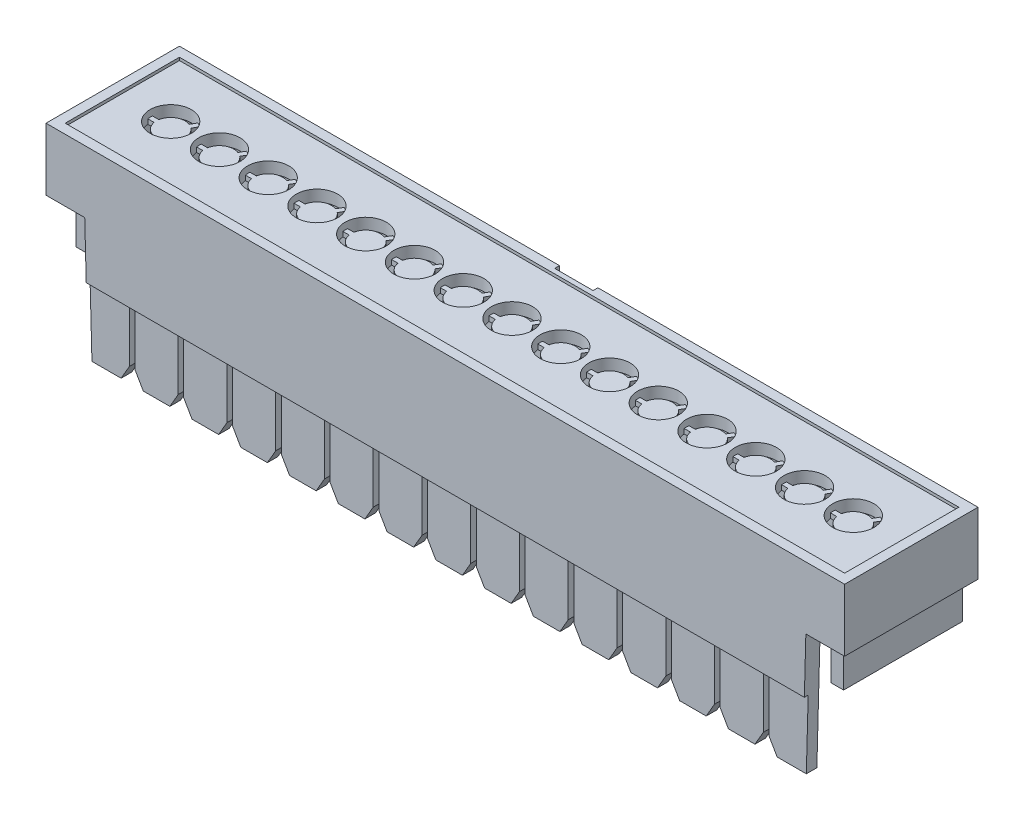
SolidWorks part; units mm, degrees
ref_plane "Спереди" through (0, 0, 0) normal (0, 0, 1) x (1, 0, 0)
ref_plane "Сверху" through (0, 0, 0) normal (0, 1, 0) x (1, 0, 0)
ref_plane "Справа" through (0, 0, 0) normal (1, 0, 0) x (0, 0, -1)
sketch "Эскиз1" plane through (0, 0, 0) normal (0, 1, 0) x (1, 0, 0)
  line L1 (41.6, -6.95) -> (-41.6, -6.95)
  line L2 (41.6, -6.95) -> (41.6, 6.95)
  line L3 (41.6, 6.95) -> (-41.6, 6.95)
  line L4 (-41.6, -6.95) -> (-41.6, 6.95)
  line L5 (41.6, -6.95) -> (-41.6, 6.95) construction
  line L6 (41.6, 6.95) -> (-41.6, -6.95) construction
  point P0 (0, 0)
  dimension "D1" = 13.9
  dimension "D2" = 83.2
extrude "Бобышка-Вытянуть1" add sketch "Эскиз1" against normal blind 6.5
sketch "Эскиз2" plane through (0, -6.5, 0) normal (0, -1, 0) x (1, 0, 0)
  line L0 (-41.6, 6.95) -> (41.6, 6.95) construction
  line L1 (38.7, -5.45) -> (-38.7, -5.45)
  line L2 (38.7, -5.45) -> (38.7, 5.45)
  line L3 (38.7, 5.45) -> (-38.7, 5.45)
  line L4 (-38.7, -5.45) -> (-38.7, 5.45)
  line L5 (38.7, -5.45) -> (-38.7, 5.45) construction
  line L6 (38.7, 5.45) -> (-38.7, -5.45) construction
  line L7 (-41.6, -6.95) -> (-41.6, 6.95) construction
  point P0 (0, 0)
  dimension "D1" = 1.5
  dimension "D2" = 2.9
extrude "Вырез-Вытянуть1" cut sketch "Эскиз2" against normal blind 5
sketch "Эскиз3" plane through (0, -6.5, 0) normal (0, -1, 0) x (1, 0, 0)
  line L0 (-38.7, 5.45) -> (-40, 5.45)
  line L1 (-40, 5.45) -> (-40, -6.95)
  line L2 (41.6, -6.95) -> (-41.6, -6.95) construction
  line L3 (-40, -6.95) -> (40, -6.95)
  line L4 (40, -6.95) -> (40, 5.45)
  line L5 (40, 5.45) -> (38.7, 5.45)
  line L6 (38.7, 5.45) -> (38.7, -5.45)
  line L7 (38.7, -5.45) -> (-38.7, -5.45)
  line L8 (-38.7, -5.45) -> (-38.7, 5.45)
  line L9 (0, 6.95) -> (0, -6.95) construction
  line L10 (-41.6, 6.95) -> (41.6, 6.95) construction
  dimension "D1" = 1.3
extrude "Бобышка-Вытянуть2" add sketch "Эскиз3" along normal blind 4.6
sketch "Эскиз4" plane through (0, 0, -6.95) normal (0, 0, -1) x (-1, 0, 0)
  line L0 (0, 0) -> (0, -11.1) construction
  line L1 (40, -11.1) -> (-40, -11.1) construction
  line L2 (-38.7, -11.1) -> (-38.7, -1.5)
  line L3 (-38.7, -1.5) -> (-37.7, -1.5)
  line L4 (-37.7, -1.5) -> (-37.4673, -10.1)
  line L5 (-37.4673, -10.1) -> (37.4673, -10.1)
  line L6 (37.4673, -10.1) -> (37.7, -1.5)
  line L7 (37.7, -1.5) -> (38.7, -1.5)
  line L8 (38.7, -1.5) -> (38.7, -11.1)
  line L9 (38.7, -11.1) -> (-38.7, -11.1)
  line L10 (-38.7, -11.1) -> (-38.7, -6.5) construction
  line L11 (-41.6, 0) -> (41.6, 0) construction
  dimension "D1" = 1
  dimension "D2" = 1
  dimension "D3" = 91.55
  dimension "D4" = 1.5
extrude "Вырез-Вытянуть2" cut sketch "Эскиз4" against normal up to surface (1.5 mm away)
sketch "Эскиз5" plane through (0, 0, 0) normal (0, 1, 0) x (1, 0, 0)
  line L0 (0, 0) -> (0, 6.95) construction
  line L1 (41.6, 6.95) -> (-41.6, 6.95) construction
  line L3 (-2, 6.95) -> (2, 6.95)
  line L4 (-2, 6.95) -> (-2, 6.45)
  line L5 (-2, 6.45) -> (2, 6.45)
  line L6 (2, 6.95) -> (2, 6.45)
  dimension "D1" = 0.5
  dimension "D2" = 4
extrude "Вырез-Вытянуть3" cut sketch "Эскиз5" against normal blind 6.5
sketch "Эскиз6" plane through (0, 0, 0) normal (1, 0, 0) x (0, 0, -1)
  line L0 (6.95, -6.5) -> (7.95, -6.5)
  line L1 (7.95, -6.5) -> (6.95, -8.9)
  line L2 (6.95, -11.1) -> (6.95, -6.5) construction
  line L3 (6.95, -8.9) -> (6.95, -6.5)
  dimension "D1" = 2.4
  dimension "D2" = 1
extrude "Бобышка-Вытянуть3" add sketch "Эскиз6" along normal mid plane 3
sketch "Эскиз7" plane through (0, 0, 6.95) normal (0, 0, 1) x (1, 0, 0)
  line L0 (-37.5647, -6.5) -> (37.5647, -6.5)
  line L1 (-41.6, -6.5) -> (41.6, -6.5) construction
  line L2 (37.5647, -6.5) -> (37.4078, -12.3)
  line L3 (37.4078, -12.3) -> (-37.4078, -12.3)
  line L4 (-37.4078, -12.3) -> (-37.5647, -6.5)
  line L5 (-37.4673, -10.1) -> (-37.7, -1.5) construction
  line L6 (37.7, -1.5) -> (37.4673, -10.1) construction
  dimension "D1" = 5.8
extrude "Бобышка-Вытянуть4" add sketch "Эскиз7" against normal up to surface (1.5 mm away)
sketch "Эскиз8" plane through (0, 0, 5.45) normal (0, 0, -1) x (-1, 0, 0)
  line L0 (0, 0) -> (0, -12.3) construction
  line L1 (-37.4078, -12.3) -> (37.4078, -12.3) construction
  line L2 (-37.4078, -12.3) -> (-37.2129, -19.5)
  line L3 (-37.2129, -19.5) -> (-34.176, -19.5)
  line L4 (-34.176, -19.5) -> (-33.31, -18)
  line L5 (-33.31, -18) -> (-33.31, -12.3)
  line L6 (37.4078, -12.3) -> (37.2129, -19.5)
  line L7 (37.2129, -19.5) -> (34.176, -19.5)
  line L8 (34.176, -19.5) -> (33.31, -18)
  line L9 (33.31, -18) -> (33.31, -12.3)
  line L10 (-37.4078, -12.3) -> (37.4078, -12.3)
  line L11 (-37.5647, -6.5) -> (-37.4078, -12.3) construction
  line L12 (-2.25, -12.3) -> (-2.25, -18)
  line L13 (-2.25, -18) -> (-1.384, -19.5)
  line L14 (-1.384, -19.5) -> (1.384, -19.5)
  line L15 (1.384, -19.5) -> (2.25, -18)
  line L16 (2.25, -18) -> (2.25, -12.3)
  line L17 (2.83, -12.3) -> (2.83, -18)
  line L18 (2.83, -18) -> (3.696, -19.5)
  line L19 (3.696, -19.5) -> (6.464, -19.5)
  line L20 (6.464, -19.5) -> (7.33, -18)
  line L21 (7.33, -18) -> (7.33, -12.3)
  line L22 (7.91, -12.3) -> (7.91, -18)
  line L23 (7.91, -18) -> (8.776, -19.5)
  line L24 (8.776, -19.5) -> (11.544, -19.5)
  line L25 (11.544, -19.5) -> (12.41, -18)
  line L26 (12.41, -18) -> (12.41, -12.3)
  line L27 (12.99, -12.3) -> (12.99, -18)
  line L28 (12.99, -18) -> (13.856, -19.5)
  line L29 (13.856, -19.5) -> (16.624, -19.5)
  line L30 (16.624, -19.5) -> (17.49, -18)
  line L31 (17.49, -18) -> (17.49, -12.3)
  line L32 (18.07, -12.3) -> (18.07, -18)
  line L33 (18.07, -18) -> (18.936, -19.5)
  line L34 (18.936, -19.5) -> (21.704, -19.5)
  line L35 (21.704, -19.5) -> (22.57, -18)
  line L36 (22.57, -18) -> (22.57, -12.3)
  line L37 (23.15, -12.3) -> (23.15, -18)
  line L38 (23.15, -18) -> (24.016, -19.5)
  line L39 (24.016, -19.5) -> (26.784, -19.5)
  line L40 (26.784, -19.5) -> (27.65, -18)
  line L41 (27.65, -18) -> (27.65, -12.3)
  line L42 (28.23, -12.3) -> (28.23, -18)
  line L43 (28.23, -18) -> (29.096, -19.5)
  line L44 (29.096, -19.5) -> (31.864, -19.5)
  line L45 (31.864, -19.5) -> (32.73, -18)
  line L46 (32.73, -18) -> (32.73, -12.3)
  line L47 (-7.33, -12.3) -> (-7.33, -18)
  line L48 (-7.33, -18) -> (-6.464, -19.5)
  line L49 (-6.464, -19.5) -> (-3.696, -19.5)
  line L50 (-3.696, -19.5) -> (-2.83, -18)
  line L51 (-2.83, -18) -> (-2.83, -12.3)
  line L52 (-12.41, -12.3) -> (-12.41, -18)
  line L53 (-12.41, -18) -> (-11.544, -19.5)
  line L54 (-11.544, -19.5) -> (-8.776, -19.5)
  line L55 (-8.776, -19.5) -> (-7.91, -18)
  line L56 (-7.91, -18) -> (-7.91, -12.3)
  line L57 (-17.49, -12.3) -> (-17.49, -18)
  line L58 (-17.49, -18) -> (-16.624, -19.5)
  line L59 (-16.624, -19.5) -> (-13.856, -19.5)
  line L60 (-13.856, -19.5) -> (-12.99, -18)
  line L61 (-12.99, -18) -> (-12.99, -12.3)
  line L62 (-22.57, -12.3) -> (-22.57, -18)
  line L63 (-22.57, -18) -> (-21.704, -19.5)
  line L64 (-21.704, -19.5) -> (-18.936, -19.5)
  line L65 (-18.936, -19.5) -> (-18.07, -18)
  line L66 (-18.07, -18) -> (-18.07, -12.3)
  line L67 (-27.65, -12.3) -> (-27.65, -18)
  line L68 (-27.65, -18) -> (-26.784, -19.5)
  line L69 (-26.784, -19.5) -> (-24.016, -19.5)
  line L70 (-24.016, -19.5) -> (-23.15, -18)
  line L71 (-23.15, -18) -> (-23.15, -12.3)
  line L72 (-32.73, -12.3) -> (-32.73, -18)
  line L73 (-32.73, -18) -> (-31.864, -19.5)
  line L74 (-31.864, -19.5) -> (-29.096, -19.5)
  line L75 (-29.096, -19.5) -> (-28.23, -18)
  line L76 (-28.23, -18) -> (-28.23, -12.3)
  point P19 (33.3459, -18)
  dimension "D1" = 7.2
  dimension "D2" = 4.5
  dimension "D3" = 30
  dimension "D4" = 1.5
  dimension "D6" = 5.08
  dimension "D7" = 5.08
  dimension "D9" = 0.58
  dimension "D5" = 7
  dimension "D8" = 7
extrude "Бобышка-Вытянуть5" add sketch "Эскиз8" against normal blind 1.1 contours L9 L8 L7 L6 M49 | L45 L46 L10 L42 L43 L44 | L40 L41 L10 L37 L38 L39 | L35 L36 L10 L32 L33 L34 | L30 L31 L10 L27 L28 L29 | L25 L26 L10 L22 L23 L24 | L20 L21 L10 L17 L18 L19 | L15 L16 L10 L12 L13 L14 M49 | L50 L51 L10 L47 L48 L49 | L55 L56 L10 L52 L53 L54 | L60 L61 L10 L57 L58 L59 | L65 L66 L10 L62 L63 L64 | L70 L71 L10 L67 L68 L69 | L75 L76 L10 L72 L73 L74 | L4 L5 L2 L3 M49
sketch "Эскиз9" plane through (0, 0, 0) normal (0, 1, 0) x (1, 0, 0)
  line L0 (-41.6, 6.95) -> (-41.6, -6.95) construction
  line L1 (40.6, -5.95) -> (-40.6, -5.95)
  line L2 (40.6, -5.95) -> (40.6, 5.95)
  line L3 (40.6, 5.95) -> (-40.6, 5.95)
  line L4 (-40.6, -5.95) -> (-40.6, 5.95)
  line L5 (40.6, -5.95) -> (-40.6, 5.95) construction
  line L6 (40.6, 5.95) -> (-40.6, -5.95) construction
  line L7 (-2, 6.95) -> (-41.6, 6.95) construction
  point P0 (0, 0)
  dimension "D1" = 1
  dimension "D2" = 1
extrude "Вырез-Вытянуть4" cut sketch "Эскиз9" against normal blind 0.3
sketch "Эскиз10" plane through (0, -0.3, 0) normal (0, 1, 0) x (1, 0, 0)
  circle A0 centre (0, 0) radius 2.15
  dimension "D1" = 4.3
extrude "Вырез-Вытянуть5" cut sketch "Эскиз10" against normal blind 0.7
sketch "Эскиз11" plane through (0, -1, 0) normal (0, 1, 0) x (1, 0, 0)
  line L0 (-1.479, 0.25) -> (-2.1354, 0.25)
  line L1 (-2.1354, -0.25) -> (-1.479, -0.25)
  line L2 (0.523, 1.4059) -> (0.8512, 1.9743)
  line L3 (0.956, 1.1559) -> (1.2842, 1.7243)
  line L4 (0.956, -1.1559) -> (1.2842, -1.7243)
  line L5 (0.8512, -1.9743) -> (0.523, -1.4059)
  line L6 (0, 0) -> (-2.15, 0) construction
  line L7 (0, 0) -> (1.075, 1.862) construction
  circle A0 centre (0, 0) radius 1.5
  circle A1 centre (0, 0) radius 2.15 construction
  arc A2 (-2.1354, 0.25) -> (0.8512, 1.9743) centre (0, 0) cw
  arc A3 (-2.1354, -0.25) -> (0.8512, -1.9743) centre (0, 0) ccw
  arc A4 (1.2842, -1.7243) -> (1.2842, 1.7243) centre (0, 0) ccw
  dimension "D1" = 3
  dimension "D2" = 0.5
  dimension "D3" = 0.5
  dimension "D4" = 0.5
  dimension "D7" = 120
extrude "Вырез-Вытянуть6" cut sketch "Эскиз11" against normal up to surface (0.5 mm away) contours A0 L2 L0 M9 | A0 L1 L5 M9 | A0 L4 L3 M9
pattern_linear "Линейный массив1" count 8 spacing 5.08 along (-1, 0, 0) count 8 spacing 5.08 along (1, 0, 0) of "Вырез-Вытянуть5", "Вырез-Вытянуть6"
